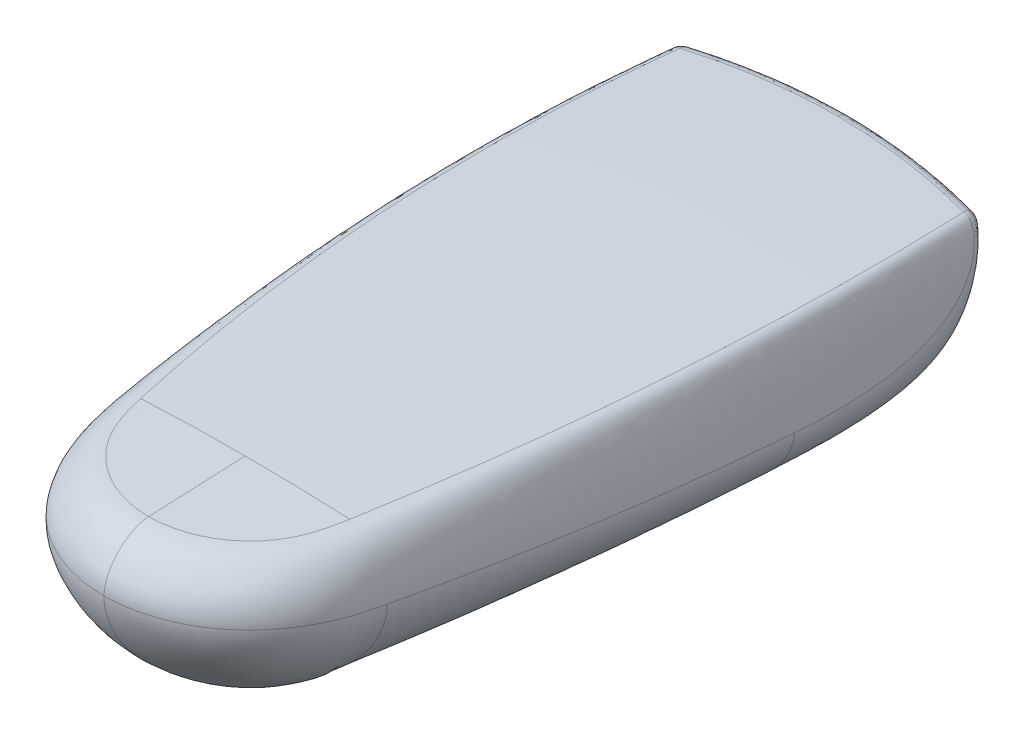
SolidWorks part; units mm, degrees
ref_plane "Front Plane" through (0, 0, 0) normal (0, 0, 1) x (1, 0, 0)
ref_plane "Top Plane" through (0, 0, 0) normal (0, 1, 0) x (1, 0, 0)
ref_plane "Right Plane" through (0, 0, 0) normal (1, 0, 0) x (0, 0, -1)
imported_body "Surface-Imported1"
sketch "AAA"
sketch "BBB"
sketch "CCC"
ref_plane "Plane1" through (0, 8.7427, 0) normal (0, 1, 0) x (-1, 0, 0)
surface "Surface-Extend6" parameters "D1"=43.54
surface "Surface-Trim1"
surface "Surface-Fill1"
surface "Surface-Trim2"
sketch3d "3DSketch1"
  spline S0 degree 3 poles (195.1802, 1991.5048, 63.5367) (11.774, -33.6633, 62.8067) (25.0156, 6.8037, 62.7995) (24.4247, -1.9632, 62.8001) (24.3677, -2.4229, 62.8002) (24.2836, -2.902, 62.8001) (24.1726, -3.3996, 62.8001) (23.9661, -4.1676, 62.8001) (23.599, -5.2323, 62.8002) (23.033, -6.5106, 62.8) (22.3532, -7.7882, 62.8002) (21.6219, -8.969, 62.8) (20.7885, -10.1458, 62.8002) (19.9731, -11.159, 62.7998) (19.0032, -12.2309, 62.8006) (17.9375, -13.2627, 62.8) (16.7423, -14.2301, 62.7997) (15.5361, -15.0445, 62.8001) (14.3415, -15.6956, 62.7998) (13.3537, -16.0919, 62.8) (12.7164, -16.2897, 62.8) (12.3949, -16.3777, 62.8) (12.0767, -16.4532, 62.8) (11.7618, -16.5164, 62.7999) (11.4505, -16.5674, 62.7999) (11.1428, -16.6067, 62.7999) (10.839, -16.6343, 62.8) (3.1251, -17.0455, 62.8005) (28.5565, -6.9173, 62.79) (-1985.3079, -148.1572, 62.1913) knots -0.975644 -0.975644 -0.975644 -0.975644 0.01841 0.037782 0.058149 0.079536 0.101959 0.125425 0.18449 0.250397 0.30976 0.375388 0.433591 0.500009 0.546917 0.624354 0.695554 0.749583 0.816282 0.874751 0.889695 0.904354 0.918739 0.932863 0.946738 0.960376 0.973791 0.986995 1.91708 1.91708 1.91708 1.91708 only from (24.4583, -1.0978, 62.8001) to (10.2421, -16.6544, 62.8) construction
  spline S1 degree 3 poles (24.4583, -1.0978, 62.8001) (24.4604, -1.2179, 62.8001) (24.458, -1.4701, 62.8001) (24.4247, -1.9632, 62.8001) (24.3677, -2.4229, 62.8002) (24.2836, -2.902, 62.8001) (24.1726, -3.3996, 62.8001) (23.9661, -4.1676, 62.8001) (23.599, -5.2323, 62.8002) (23.033, -6.5106, 62.8) (22.3532, -7.7882, 62.8002) (21.6219, -8.969, 62.8) (20.7885, -10.1458, 62.8002) (19.9731, -11.159, 62.7998) (19.0032, -12.2309, 62.8006) (17.9375, -13.2627, 62.8) (16.7423, -14.2301, 62.7997) (15.5361, -15.0445, 62.8001) (14.3415, -15.6956, 62.7998) (13.3537, -16.0919, 62.8) (12.7164, -16.2897, 62.8) (12.3949, -16.3777, 62.8) (12.0767, -16.4532, 62.8) (11.7618, -16.5164, 62.7999) (11.4505, -16.5674, 62.7999) (11.1428, -16.6067, 62.7999) (10.839, -16.6343, 62.8) (10.5196, -16.6513, 62.8) (10.3337, -16.6544, 62.8) (10.2421, -16.6544, 62.8) knots 0 0 0 0 0.01841 0.037782 0.058149 0.079536 0.101959 0.125425 0.18449 0.250397 0.30976 0.375388 0.433591 0.500009 0.546917 0.624354 0.695554 0.749583 0.816282 0.874751 0.889695 0.904354 0.918739 0.932863 0.946738 0.960376 0.973791 0.986995 1 1 1 1
sketch3d "3DSketch2"
  line L0 (0, -0.0002, 87.122) -> (-29.9108, 0.0003, 87.2896)
  spline S0 degree 3 poles (1572.0319, 143.5076, -1120.8956) (-213.138, -5.2372, -107.6072) (-51.3562, 0.1624, 110.446) (12.2206, -0.0113, 84.0128) (14.9186, -0.0336, 82.2259) (18.2561, -0.1307, 78.8329) (19.2494, -0.1741, 77.5833) (20.9773, -0.2876, 74.9193) (21.71, -0.3575, 73.5038) (22.9024, -0.5258, 70.564) (23.3627, -0.6241, 69.0395) (23.7666, -0.7659, 67.1001) (23.8368, -0.7954, 66.7102) (23.9698, -0.8552, 65.9294) (40.7333, -8.6305, -35.1821) (-50.6667, -24.5835, -151.8928) (2006.7683, 189.3991, 58.5642) knots -4.914525 -4.914525 -4.914525 -4.914525 0.25 0.25 0.5 0.5 0.625 0.625 0.75 0.75 0.875 0.875 0.90625 0.90625 0.9375 8.994982 8.994982 8.994982 8.994982 only from (0, -0.0002, 87.122) to (24.4583, -1.0978, 62.8001) construction
  spline S1 degree 3 poles (0, -0.0002, 87.122) (3.1772, -0.0002, 87.1042) (6.3496, 0.0048, 86.4538) (12.2206, -0.0113, 84.0128) (14.9186, -0.0336, 82.2259) (18.2561, -0.1307, 78.8329) (19.2494, -0.1741, 77.5833) (20.9773, -0.2876, 74.9193) (21.71, -0.3575, 73.5038) (22.9024, -0.5258, 70.564) (23.3627, -0.6241, 69.0395) (23.7666, -0.7659, 67.1001) (23.8368, -0.7954, 66.7102) (23.9698, -0.8552, 65.9294) (24.1641, -0.9454, 64.7575) (24.3439, -1.0366, 63.5835) (24.4583, -1.0978, 62.8001) knots 0 0 0 0 0.25 0.25 0.5 0.5 0.625 0.625 0.75 0.75 0.875 0.875 0.90625 0.90625 0.9375 1 1 1 1
ref_plane "Plane2" through (0, -16.6544, 0) normal (0, 1, 0) x (-1, 0, 0)
sketch "Sketch3" plane through (0, -16.6544, 0) normal (0, 1, 0) x (-1, 0, 0)
  line L0 (0.0002, 73.6925) -> (31.7635, 73.1985)
  spline S0 degree 2 poles (1309.4327, -1434.1541) (-35.7624, -694.2537) (-11.969, 30.6943) (11.8021, 754.9602) (1400.2697, 1406.5483) knots -21.060875 -21.060875 -21.060875 0.5 0.5 22.041291 22.041291 22.041291 only from (-12.3363, -2.9371) to (-10.2421, 62.8) construction
  spline S1 degree 2 poles (-12.3363, -2.9371) (-12.5207, 13.8826) (-11.969, 30.6943) (-11.4415, 46.765) (-10.2421, 62.8) knots 0 0 0 0.5 0.5 0.97798 0.97798 0.97798
  spline S2 degree 3 poles (-10.2421, 62.8) (-10.2358, 62.8853) (-10.1088, 64.5796) (-9.8485, 67.2257) (-7.5296, 70.6611) (-4.2629, 73.0716) (-1.5722, 73.7169) (0.0002, 73.6925) knots 0 0 0 0 0.013857 0.277142 0.510082 0.726463 1 1 1 1
  spline S3 degree 3 poles (0, 62.8) (0.0002, 68.3463) (0.0003, 73.8932) (0, 79.441) knots 0 0 0 0 1 1 1 1 construction
surface "Surface-Sweep2"
surface "Surface-Trim6"
surface "Surface-Fill4"
surface "Surface-Trim7"
ref_plane "Plane3" through (-0.0001, -0.0002, 62.8) normal (0, 0, -1) x (-1, 0, 0)
sketch3d "3DSketch3"
  spline S0 degree 1 poles (18.0129, 8.3074, 62.8004) (24.4583, -1.0978, 62.8001) knots 0 0 1 1
sketch3d "3DSketch4"
  spline S0 degree 3 poles (748.3443, -1846.2216, 215.026) (0, -41.3754, 87.122) (0, -20.6887, 87.1224) (0, 0.3579, 87.1222) (0, 1.3172, 87.03) (0, 4.3992, 86.0084) (0, 7.086, 83.2029) (0, 15.3534, 55.3175) (0, -140.7519, 21.9721) (0, -1652.8919, 1188.2868) knots -5.450094 -5.450094 -5.450094 -5.450094 0.000017 0.000017 0.094309 0.251464 0.817219 0.935084 7.649858 7.649858 7.649858 7.649858 only from (0, -0.0002, 87.1222) to (0, 8.0246, 79.441) construction
  spline S1 degree 3 poles (0, -0.0002, 87.1222) (0, -0.0001, 87.1222) (0, -0.0001, 87.1222) (0, 0.3579, 87.1222) (0, 1.3172, 87.03) (0, 4.3992, 86.0084) (0, 7.086, 83.2029) (0, 7.9224, 80.3816) (0, 8.0095, 79.6872) (0, 8.0246, 79.441) knots 0 0 0 0 0.000017 0.000017 0.094309 0.251464 0.817219 0.935084 1 1 1 1
mirror "Mirror1" about plane through (0, 0, 0) normal (1, 0, 0)
surface "Surface-Knit1"
